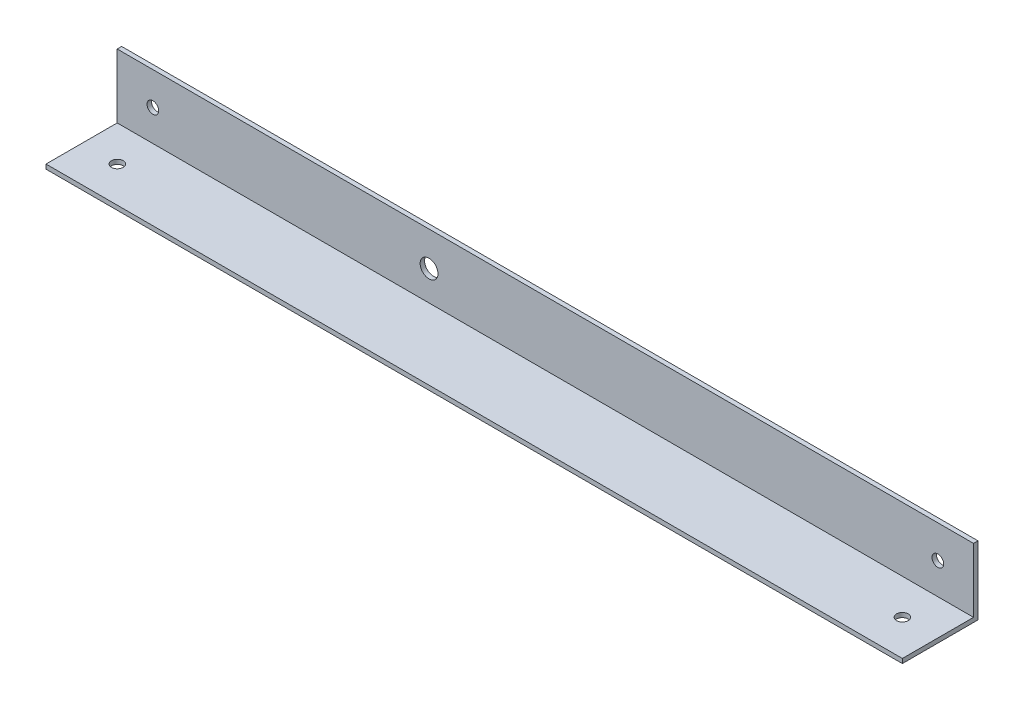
SolidWorks part; units mm, degrees
ref_plane "Front" through (0, 0, 0) normal (0, 0, 1) x (1, 0, 0)
ref_plane "Top" through (0, 0, 0) normal (0, 1, 0) x (1, 0, 0)
ref_plane "Right" through (0, 0, 0) normal (1, 0, 0) x (0, 0, -1)
sketch "Sketch1" plane through (0, 0, 0) normal (0, 0, 1) x (1, 0, 0)
  line L1 (-209.8261, 67.8385) -> (94.9739, 67.8385)
  line L2 (-209.8261, 67.8385) -> (-209.8261, 43.4545)
  line L3 (-209.8261, 43.4545) -> (94.9739, 43.4545)
  line L4 (94.9739, 67.8385) -> (94.9739, 43.4545)
  dimension "D1" = 304.8
  dimension "D2" = 24.384
extrude "Boss-Extrude1" add sketch "Sketch1" along normal blind 26.924
sketch "Sketch2" plane through (0, 67.8385, 0) normal (0, 1, 0) x (1, 0, 0)
  line L0 (-209.8261, -26.924) -> (-209.8261, 0) construction
  line L1 (-209.8261, -1.5875) -> (94.9739, -1.5875)
  line L2 (-209.8261, -1.5875) -> (-209.8261, -26.924)
  line L3 (-209.8261, -26.924) -> (94.9739, -26.924)
  line L4 (94.9739, -1.5875) -> (94.9739, -26.924)
  line L5 (94.9739, 0) -> (-209.8261, 0) construction
  dimension "D1" = 1.5875
extrude "Cut-Extrude1" cut sketch "Sketch2" against normal blind 12.7
sketch "Sketch3" plane through (0, 0, 26.924) normal (0, 0, 1) x (1, 0, 0)
  line L0 (94.9739, 43.4545) -> (94.9739, 55.1385) construction
  line L1 (-209.8261, 55.1385) -> (94.9739, 55.1385)
  line L2 (-209.8261, 55.1385) -> (-209.8261, 45.042)
  line L3 (-209.8261, 45.042) -> (94.9739, 45.042)
  line L4 (94.9739, 55.1385) -> (94.9739, 45.042)
  line L5 (-209.8261, 43.4545) -> (94.9739, 43.4545) construction
  dimension "D1" = 1.5875
extrude "Cut-Extrude3" cut sketch "Sketch3" against normal up to surface (25.3365 mm away)
sketch "Sketch4" plane through (0, 0, 0) normal (0, 0, -1) x (-1, 0, 0)
  line L0 (-94.9739, 43.4545) -> (-94.9739, 67.8385) construction
  line L1 (209.8261, 43.4545) -> (-94.9739, 43.4545) construction
  line L2 (57.4261, 28.0211) -> (57.4261, 119.205) construction
  circle A0 centre (-82.2739, 56.1545) radius 2.0828
  circle A1 centre (197.1261, 56.1545) radius 2.0828
  dimension "D3" = 4.1656
  dimension "D1" = 12.7
  dimension "D2" = 12.7
extrude "Cut-Extrude4" cut sketch "Sketch4" against normal blind 2.54
sketch "Sketch5" plane through (0, 43.4545, 0) normal (0, -1, 0) x (1, 0, 0)
  line L0 (-57.4261, 38.6497) -> (-57.4261, -24.6724) construction
  line L1 (-209.8261, 26.924) -> (-209.8261, 0) construction
  line L2 (-209.8261, 26.924) -> (94.9739, 26.924) construction
  circle A0 centre (-197.1261, 14.224) radius 2.0828
  circle A1 centre (82.2739, 14.224) radius 2.0828
  dimension "D1" = 4.1656
  dimension "D2" = 12.7
  dimension "D3" = 12.7
extrude "Cut-Extrude5" cut sketch "Sketch5" against normal blind 2.54
sketch "Sketch6" plane through (0, 0, 0) normal (0, 0, -1) x (-1, 0, 0)
  line L0 (-94.9739, 43.4545) -> (-94.9739, 67.8385) construction
  line L1 (209.8261, 67.8385) -> (209.8261, 43.4545) construction
  circle A0 centre (98.8281, 55.6465) radius 3.18
  point P7 (-94.9739, 55.6465)
  dimension "D2" = 6.36
  dimension "D1" = 110.998
extrude "Cut-Extrude6" cut sketch "Sketch6" against normal blind 2.54
equation "\".5n\"=1"
